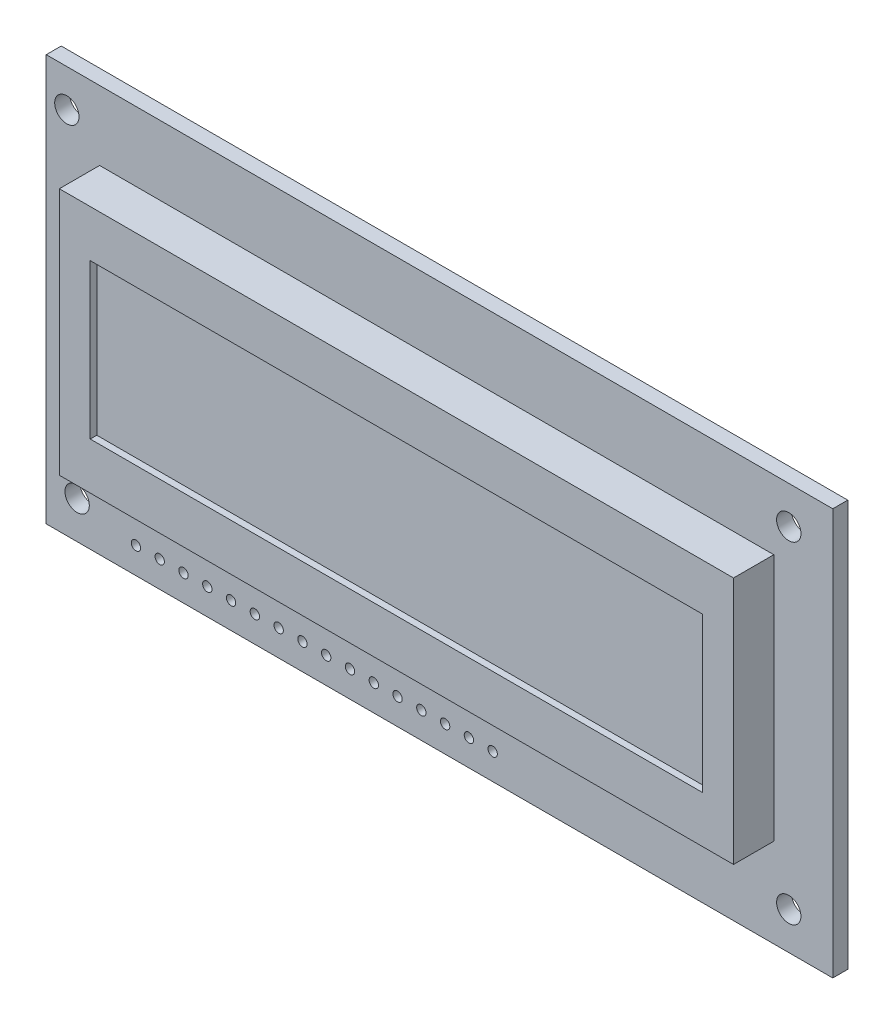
SolidWorks part; units mm, degrees
ref_plane "Plan de face" through (0, 0, 0) normal (0, 0, 1) x (1, 0, 0)
ref_plane "Plan de dessus" through (0, 0, 0) normal (0, 1, 0) x (1, 0, 0)
ref_plane "Plan de droite" through (0, 0, 0) normal (1, 0, 0) x (0, 0, -1)
sketch "Esquisse1" plane through (0, 0, 0) normal (0, 0, 1) x (1, 0, 0)
  line L0 (0, -29.2621) -> (0, 57.4681) construction
  line L3 (8.2, 43.4) -> (92.2, 43.4)
  line L4 (92.2, 0) -> (92.2, 43.4)
  line L5 (8.2, 48.392) -> (8.2, -0.6377) construction
  line L6 (97.1827, 21.7) -> (84.0955, 21.7) construction
  line L7 (-8.2241, 4) -> (94.3535, 4) construction
  line L9 (11.5, 7.0971) -> (11.5, -8.2628) construction
  line L10 (87.5, 7.0971) -> (87.5, -29.2621) construction
  line L11 (82, 7.0971) -> (82, -25.9099) construction
  line L12 (-8.2241, 0) -> (97.1827, 0) construction
  line L13 (92.2, 52.1367) -> (92.2, 33.239) construction
  line L14 (10.4, 57.4681) -> (10.4, 37.4709) construction
  line L15 (8.2, 43.4) -> (8.2, 0)
  line L17 (13.1027, 2.8) -> (78.6127, 2.8) construction
  line L18 (17.78, -12.303) -> (17.78, 6.0543) construction
  line L19 (8.2, 0) -> (92.2, 0)
  circle A1 centre (11.5, 4) radius 1.3
  circle A3 centre (87.5, 4) radius 1.3
  circle A4 centre (10.4, 39.4) radius 1.3
  circle A7 centre (87.5, 39.4) radius 1.3
  circle A24 centre (17.78, 2.8) radius 0.5
  circle A25 centre (20.32, 2.8) radius 0.5
  circle A30 centre (22.86, 2.8) radius 0.5
  circle A31 centre (25.4, 2.8) radius 0.5
  circle A32 centre (27.94, 2.8) radius 0.5
  circle A33 centre (30.48, 2.8) radius 0.5
  circle A34 centre (33.02, 2.8) radius 0.5
  circle A35 centre (35.56, 2.8) radius 0.5
  circle A36 centre (38.1, 2.8) radius 0.5
  circle A37 centre (40.64, 2.8) radius 0.5
  circle A38 centre (43.18, 2.8) radius 0.5
  circle A39 centre (45.72, 2.8) radius 0.5
  circle A40 centre (48.26, 2.8) radius 0.5
  circle A41 centre (50.8, 2.8) radius 0.5
  circle A42 centre (53.34, 2.8) radius 0.5
  circle A43 centre (55.88, 2.8) radius 0.5
  dimension "D7" = 21.7
  dimension "D10" = 84
  dimension "D12" = 17.78
  dimension "D3" = 11.5
  dimension "D4" = 4
  dimension "D5" = 82
  dimension "D6" = 87.5
  dimension "D9" = 10.4
extrude "Extrusion1" add sketch "Esquisse1" along normal blind 1.6
sketch "Esquisse2" plane through (0, 0, 1.6) normal (0, 0, 1) x (1, 0, 0)
  line L0 (104.4369, 43.4) -> (1.9454, 43.4) construction
  line L1 (104.4369, 36) -> (1.9454, 36) construction
  line L2 (104.4369, 9.5) -> (1.9454, 9.5) construction
  line L3 (85.9, 52.4602) -> (85.9, -5.2731) construction
  line L4 (92.2, 52.4602) -> (92.2, -4.2018) construction
  line L5 (13.9, 52.4602) -> (13.9, -5.2731) construction
  line L7 (13.9, 36) -> (85.9, 36)
  line L8 (13.9, 36) -> (13.9, 9.5)
  line L9 (13.9, 9.5) -> (85.9, 9.5)
  line L10 (85.9, 36) -> (85.9, 9.5)
  dimension "D1" = 7.4
  dimension "D2" = 26.5
  dimension "D3" = 6.3
  dimension "D4" = 72
extrude "Extrusion2" add sketch "Esquisse2" along normal blind 4.3
sketch "Esquisse3" plane through (0, 0, 5.9) normal (0, 0, 1) x (1, 0, 0)
  line L0 (17.2, 5.316) -> (17.2, 37.6079) construction
  line L1 (11.2434, 31) -> (89.712, 31) construction
  line L2 (82.6, 37.6079) -> (82.6, 7.6963) construction
  line L3 (89.712, 14.5) -> (11.2434, 14.5) construction
  line L4 (85.9, 36) -> (13.9, 36) construction
  line L5 (85.9, 9.5) -> (85.9, 36) construction
  line L6 (13.9, 9.5) -> (85.9, 9.5) construction
  line L7 (13.9, 36) -> (13.9, 9.5) construction
  line L9 (17.2, 31) -> (82.6, 31)
  line L10 (17.2, 31) -> (17.2, 14.5)
  line L11 (17.2, 14.5) -> (82.6, 14.5)
  line L12 (82.6, 31) -> (82.6, 14.5)
  dimension "D1" = 5
  dimension "D2" = 3.3
  dimension "D3" = 5
  dimension "D4" = 3.3
extrude "Enlèv. mat.-Extru.1" cut sketch "Esquisse3" against normal blind 0.7
